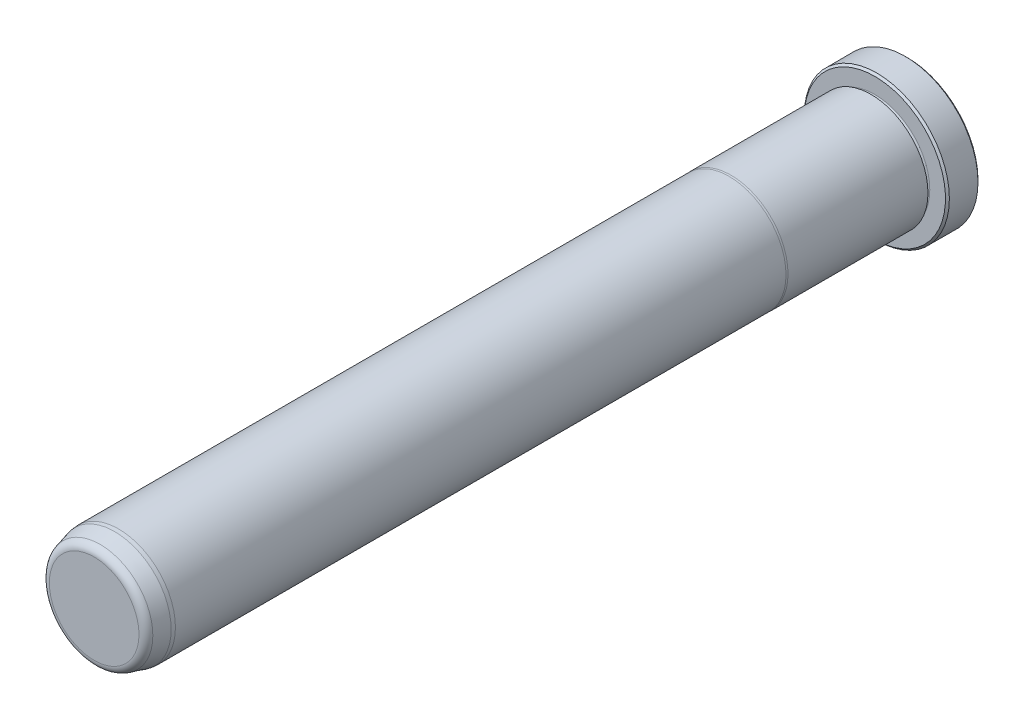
SolidWorks part; units mm, degrees
ref_plane "Front Plane" through (0, 0, 0) normal (0, 0, 1) x (1, 0, 0)
ref_plane "Top Plane" through (0, 0, 0) normal (0, 1, 0) x (1, 0, 0)
ref_plane "Right Plane" through (0, 0, 0) normal (1, 0, 0) x (0, 0, -1)
sketch "Sketch1" plane through (0, 0, 0) normal (1, 0, 0) x (0, 0, -1)
  line L0 (0, 0) -> (0, 14.1605)
  line L1 (0, 14.1605) -> (-6.35, 14.1605)
  line L2 (-6.35, 14.1605) -> (-6.35, 10.7188)
  line L3 (-6.35, 10.3378) -> (-7.112, 10.3378) construction
  line L4 (-7.112, 10.7188) -> (-7.112, 11.1252)
  line L5 (-7.112, 11.1252) -> (-34.4348, 11.1252)
  line L6 (-34.4348, 11.1252) -> (-34.798, 11.0998)
  line L7 (-34.798, 11.0998) -> (-153.9875, 11.0998)
  line L9 (-158.75, 9.9612) -> (-158.75, 0)
  line L10 (-158.75, 0) -> (0, 0)
  line L11 (0, 0) -> (13.6287, 0) construction
  line L12 (-153.9875, 11.0998) -> (-154.7495, 11.0331)
  line L13 (-154.7495, 11.0331) -> (-158.75, 9.9612)
  arc A0 (-7.112, 10.7188) -> (-6.35, 10.7188) centre (-6.731, 10.7188) ccw
  dimension "D14" = 0.762
  dimension "D1" = 6.35
  dimension "D2" = 0.762
  dimension "D3" = 28.321
  dimension "D4" = 22.2504
  dimension "D5" = 34.798
  dimension "D6" = 158.75
  dimension "D7" = 0.7874
  dimension "D8" = 4
  dimension "D9" = 22.1996
  dimension "D10" = 5
  dimension "D11" = 15
  dimension "D12" = 0.762
  dimension "D13" = 4.7625
revolve "Revolve1" add sketch "Sketch1" angle 360 about L11
fillet "Fillet6" radius 1.5875 1 edges at (9.9612, 0, 158.75)
chamfer "Chamfer1" distance 0.381 angle 45 2 edges at (14.1605, 0, 0) (14.1605, 0, 6.35)
